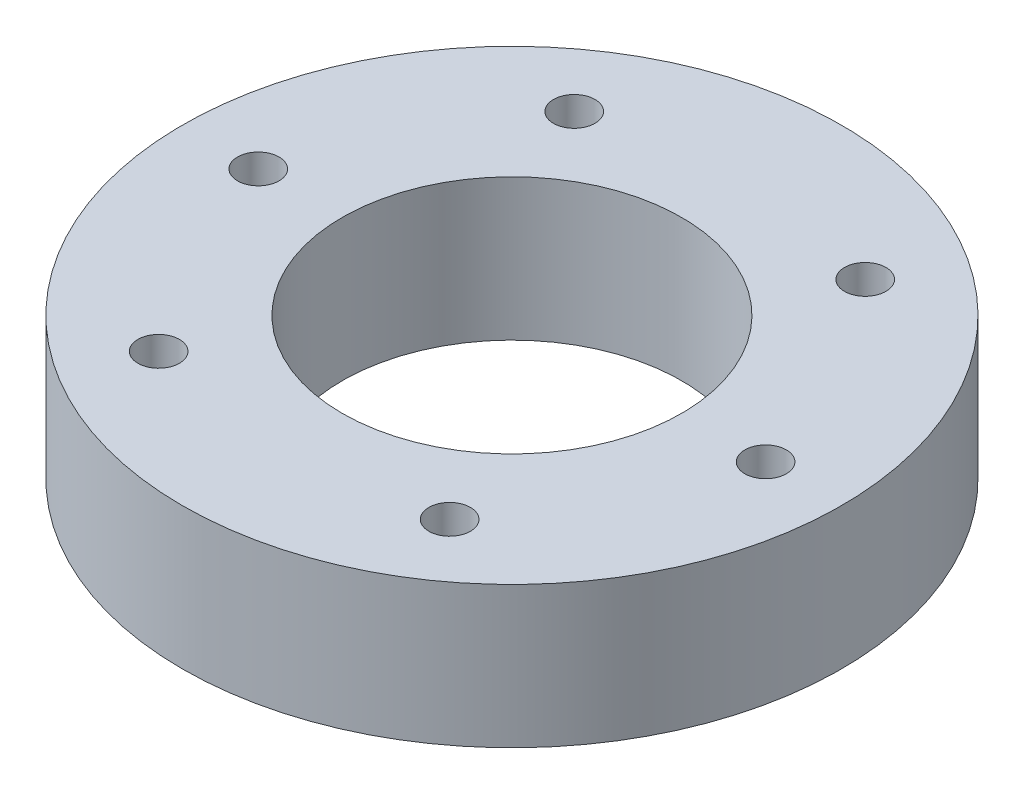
SolidWorks part; units mm, degrees
ref_plane "Front Plane" through (0, 0, 0) normal (0, 0, 1) x (1, 0, 0)
ref_plane "Top Plane" through (0, 0, 0) normal (0, 1, 0) x (1, 0, 0)
ref_plane "Right Plane" through (0, 0, 0) normal (1, 0, 0) x (0, 0, -1)
sketch "Sketch1" plane through (0, 0, 0) normal (0, 1, 0) x (1, 0, 0)
  circle A0 centre (0, 0) radius 18
  circle A1 centre (0, 0) radius 34.95
  dimension "D1" = 36
  dimension "D2" = 69.9
extrude "Boss-Extrude1" add sketch "Sketch1" along normal mid plane 15
sketch "Sketch2" plane through (0, 7.5, 0) normal (0, 1, 0) x (1, 0, 0)
  line L2 (-18, 0) -> (26.9, 0) construction
  circle A1 centre (-15.4292, -22.0352) radius 2.2
  circle A2 centre (-26.9, 0) radius 2.2
  circle A3 centre (-15.4292, 22.0352) radius 2.2
  circle A4 centre (15.4292, 22.0352) radius 2.2
  circle A5 centre (26.9, 0) radius 2.2
  circle A6 centre (15.4292, -22.0352) radius 2.2
  circle A8 centre (0, 0) radius 26.9 construction
  circle A9 centre (0, 0) radius 18 construction
  dimension "D1" = 4.4
  dimension "D6" = 53.8
  dimension "D2" = 55
  dimension "D3" = 55
  dimension "D4" = 55
  dimension "D5" = 55
extrude "Cut-Extrude1" cut sketch "Sketch2" against normal blind 10
